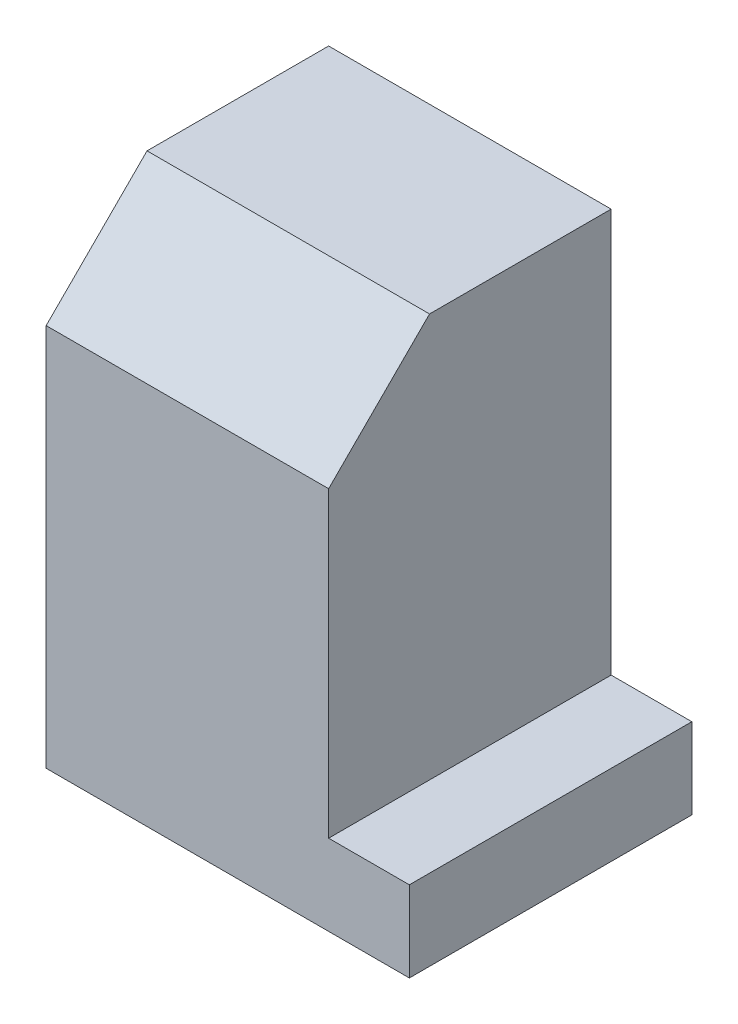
SolidWorks part; units mm, degrees
ref_plane "前视基准面" through (0, 0, 0) normal (0, 0, 1) x (1, 0, 0)
ref_plane "上视基准面" through (0, 0, 0) normal (0, 1, 0) x (1, 0, 0)
ref_plane "右视基准面" through (0, 0, 0) normal (1, 0, 0) x (0, 0, -1)
sketch "草图1" plane through (0, 0, 0) normal (0, 0, 1) x (1, 0, 0)
  line L0 (0, 0) -> (90, 0)
  line L1 (90, 0) -> (90, 20)
  line L2 (90, 20) -> (70, 20)
  line L3 (70, 20) -> (70, 120)
  line L4 (0, 120) -> (0, 0)
  line L5 (70, 120) -> (0, 120)
extrude "拉伸1" add sketch "草图1" along normal blind 70
sketch "草图2" plane through (70, 0, 0) normal (1, 0, 0) x (0, 0, -1)
  line L0 (-45, 120) -> (-70, 95)
  line L1 (-70, 120) -> (0, 120) construction
  line L2 (-70, 20) -> (-70, 120) construction
  line L3 (-70, 95) -> (-70, 120)
  line L4 (-70, 120) -> (-45, 120)
extrude "切除-拉伸1" cut sketch "草图2" against normal through all
